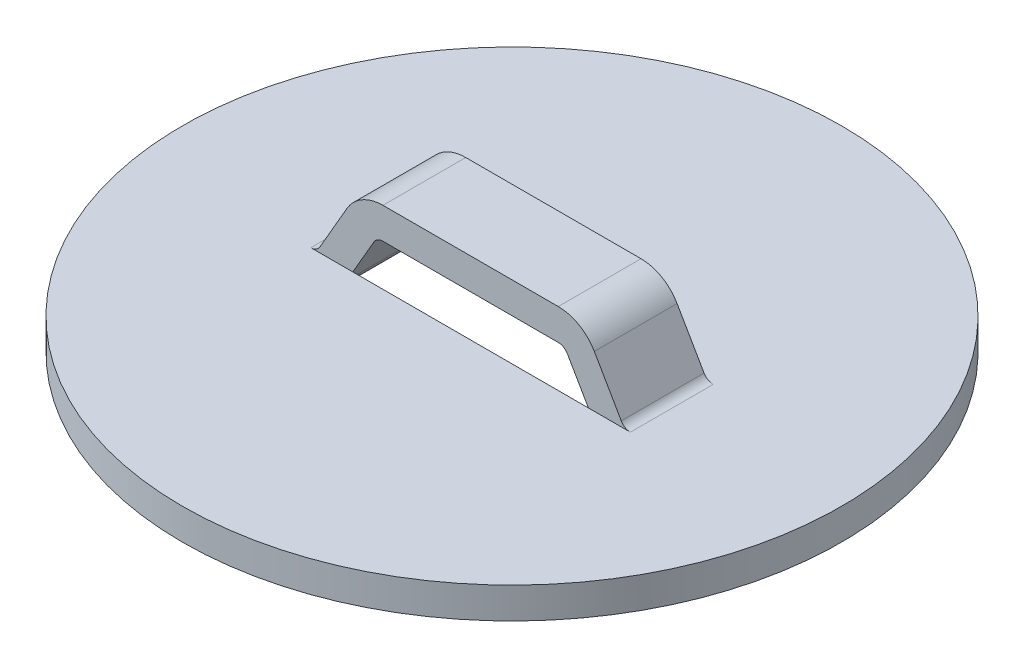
SolidWorks part; units mm, degrees
other "Boss-Extrude1"
ref_plane "Front Plane" through (0, 0, 0) normal (0, 0, 1) x (1, 0, 0)
ref_plane "Top Plane" through (0, 0, 0) normal (0, 1, 0) x (1, 0, 0)
ref_plane "Right Plane" through (0, 0, 0) normal (1, 0, 0) x (0, 0, -1)
imported_body "Imported1"
sketch "Sketch1" plane through (0, -1.4986, 0) normal (0, -1, 0) x (1, 0, 0)
  line L0 (0, 0) -> (0, -3.9878) construction
  line L1 (4.2219, -3.9878) -> (-4.2219, -3.9878) construction
  line L2 (15.875, -3.9878) -> (15.875, 0) construction
  line L3 (-7.6974, -3.9878) -> (7.6974, -3.9878)
  line L4 (-7.6974, -3.9878) -> (-7.6974, 0)
  line L5 (-7.6974, 0) -> (7.6974, 0)
  line L6 (7.6974, -3.9878) -> (7.6974, 0)
  line L7 (-7.6974, -3.9878) -> (7.6974, 0) construction
  line L8 (-7.6974, 0) -> (7.6974, -3.9878) construction
  circle A0 centre (0, -1.9939) radius 15.875
  point P5 (0, -1.9939)
extrude "Boss-Extrude1" add sketch "Sketch1" against normal up to vertex
other "DeleteFace1"
